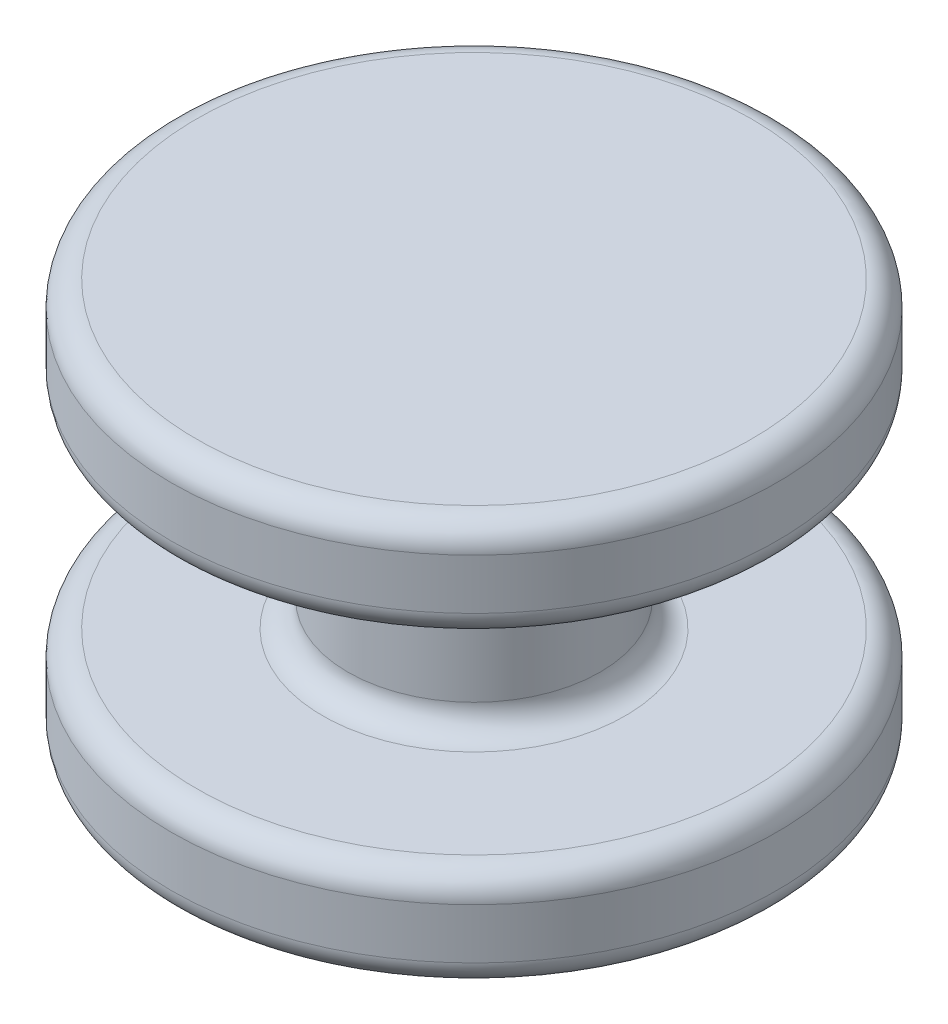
SolidWorks part; units mm, degrees
ref_plane "Front" through (0, 0, 0) normal (0, 0, 1) x (1, 0, 0)
ref_plane "Top" through (0, 0, 0) normal (0, 1, 0) x (1, 0, 0)
ref_plane "Right" through (0, 0, 0) normal (1, 0, 0) x (0, 0, -1)
sketch "Sketch1" plane through (0, 0, 0) normal (0, 0, 1) x (1, 0, 0)
  line L0 (0, -4) -> (0, 4)
  line L1 (0, 4) -> (5.5, 4)
  line L2 (6, 3.5) -> (6, 2.5)
  line L3 (5.5, 2) -> (3, 2)
  line L4 (2.5, 1.5) -> (2.5, -1.5)
  line L5 (0, 0) -> (2.5, 0) construction
  line L6 (5.5, -2) -> (3, -2)
  line L7 (6, -3.5) -> (6, -2.5)
  line L8 (0, -4) -> (5.5, -4)
  arc A0 (3, 2) -> (2.5, 1.5) centre (3, 1.5) ccw
  arc A1 (3, -2) -> (2.5, -1.5) centre (3, -1.5) cw
  arc A2 (6, 2.5) -> (5.5, 2) centre (5.5, 2.5) cw
  arc A3 (5.5, -2) -> (6, -2.5) centre (5.5, -2.5) cw
  arc A4 (5.5, 4) -> (6, 3.5) centre (5.5, 3.5) cw
  arc A5 (6, -3.5) -> (5.5, -4) centre (5.5, -3.5) cw
  point P13 (2.5, 2)
  point P16 (2.5, -2)
  point P19 (6, 2)
  point P22 (6, -2)
  point P25 (6, 4)
  point P28 (6, -4)
  dimension "D5" = 0.5
  dimension "D1" = 2.5
  dimension "D2" = 6
  dimension "D3" = 8
  dimension "D4" = 4
revolve "Revolve1" add sketch "Sketch1" angle 360 about L0
